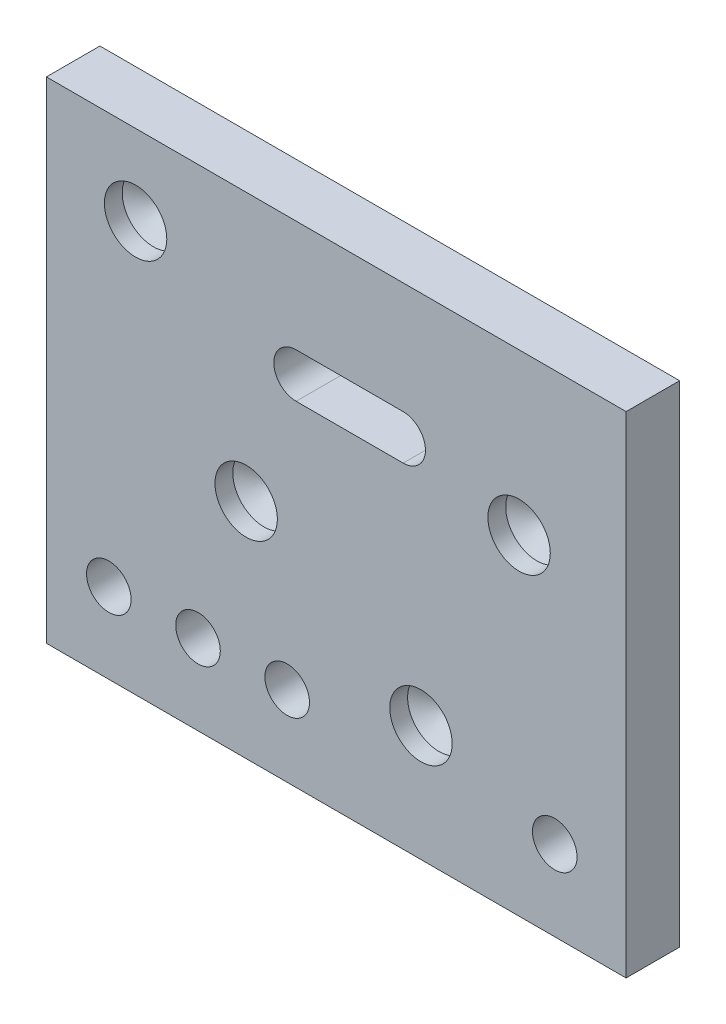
SolidWorks part; units mm, degrees
ref_plane "Front" through (0, 0, 0) normal (0, 0, 1) x (1, 0, 0)
ref_plane "Top" through (0, 0, 0) normal (0, 1, 0) x (1, 0, 0)
ref_plane "Right" through (0, 0, 0) normal (1, 0, 0) x (0, 0, -1)
sketch "Sketch1" plane through (0, 0, 0) normal (0, 0, 1) x (1, 0, 0)
  line L1 (0, 0) -> (325, 0)
  line L2 (0, 0) -> (0, 275)
  line L3 (0, 275) -> (325, 275)
  line L4 (325, 0) -> (325, 275)
  dimension "D1" = 325
  dimension "D2" = 275
extrude "Extrude1" add sketch "Sketch1" along normal blind 30
hole_wizard "M25.0 (25.000000) Diameter Hole1" positions "Sketch4" profile "Sketch5" hole size "M25.0" standard "Ansi Metric"
sketch "Sketch4" plane through (0, 0, 30) normal (0, 0, 1) x (1, 0, 0)
  line L0 (0, 275) -> (0, 0) construction
  line L1 (0, 0) -> (325, 0) construction
  point P0 (35, 45)
  dimension "D1" = 35
  dimension "D2" = 45
sketch "Sketch5" plane through (35, 45, 30) normal (1, 0, 0) x (0, -1, 0)
  line L0 (0, 0) -> (0, 30)
  line L1 (0, 30) -> (12.5, 30)
  line L2 (12.5, 30) -> (12.5, 0)
  line L5 (12.5, 0) -> (0, 0)
  line L11 (0, -6.35) -> (0, 107.95) construction
  dimension "Thru Hole Dia." = 25
  dimension "Thru Hole Depth" = 30
pattern_linear "LPattern1" count 6 spacing 50 along (1, 0, 0) of "M25.0 (25.000000) Diameter Hole1"
hole_wizard "Tap Drill for M39x4.0 Tap1" positions "Sketch7" profile "Sketch6" hole size "M39x4.0" standard "Ansi Metric"
sketch "Sketch7" plane through (0, 0, 30) normal (0, 0, 1) x (1, 0, 0)
  line L0 (0, 0) -> (325, 0) construction
  line L1 (0, 275) -> (0, 0) construction
  point P0 (50, 230)
  dimension "D1" = 230
  dimension "D2" = 50
sketch "Sketch6" plane through (50, 230, 30) normal (1, 0, 0) x (0, -1, 0)
  line L0 (0, 0) -> (0, 20.5151)
  line L1 (0, 20.5151) -> (17.5, 10)
  line L2 (17.5, 10) -> (17.5, 0)
  line L5 (17.5, 0) -> (0, 0)
  line L10 (0, 20.5151) -> (-17.5, 10) construction
  line L11 (0, -6.35) -> (0, 107.95) construction
  dimension "Hole Dia." = 35
  dimension "Hole Depth" = 10
  dimension "Drill Angle" = 118
sketch "Sketch8" plane through (0, 0, 30) normal (0, 0, 1) x (1, 0, 0)
  line L0 (0, 275) -> (0, 0) construction
  line L1 (0, 0) -> (325, 0) construction
  point P0 (112, 125)
  point P1 (265, 185)
  point P2 (210, 65)
  dimension "D1" = 112
  dimension "D2" = 210
  dimension "D3" = 265
  dimension "D4" = 65
  dimension "D5" = 125
  dimension "D6" = 185
pattern_sketch "Sketch-Pattern1" of "Tap Drill for M39x4.0 Tap1"
sketch "Sketch9" plane through (0, 0, 30) normal (0, 0, 1) x (1, 0, 0)
  line L0 (140, 212.5) -> (200, 212.5)
  line L1 (140, 187.5) -> (200, 187.5)
  line L2 (0, 0) -> (325, 0) construction
  line L3 (0, 275) -> (0, 0) construction
  line L4 (140, 200) -> (200, 200) construction
  arc A0 (200, 187.5) -> (200, 212.5) centre (200, 200) ccw
  arc A1 (140, 187.5) -> (140, 212.5) centre (140, 200) cw
  point P10 (170, 200)
  dimension "D1" = 200
  dimension "D3" = 200
  dimension "D2" = 140
  dimension "D4" = 25
extrude "Cut-Extrude1" cut sketch "Sketch9" against normal through all
